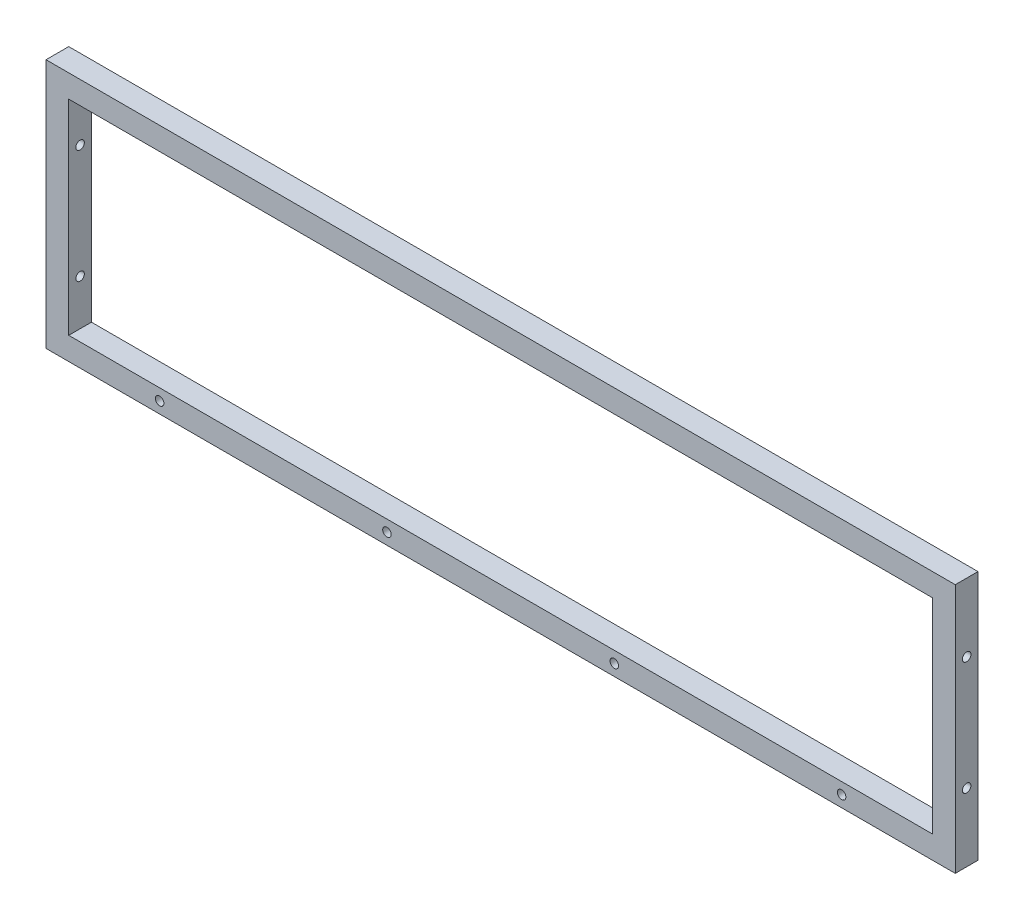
SolidWorks part; units mm, degrees
other "Outer tubes"
ref_plane "Front Plane" through (0, 0, 0) normal (0, 0, 1) x (1, 0, 0)
ref_plane "Top Plane" through (0, 0, 0) normal (0, 1, 0) x (1, 0, 0)
ref_plane "Right Plane" through (0, 0, 0) normal (1, 0, 0) x (0, 0, -1)
sketch "Sketch1" plane through (0, 0, 0) normal (0, 0, 1) x (1, 0, 0)
  line L1 (482.6, -114.3) -> (-482.6, -114.3)
  line L2 (482.6, -114.3) -> (482.6, 114.3)
  line L3 (482.6, 114.3) -> (-482.6, 114.3)
  line L4 (-482.6, -114.3) -> (-482.6, 114.3)
  line L5 (482.6, -114.3) -> (-482.6, 114.3) construction
  line L6 (482.6, 114.3) -> (-482.6, -114.3) construction
  line L7 (508, -139.7) -> (-508, -139.7)
  line L8 (508, -139.7) -> (508, 139.7)
  line L9 (508, 139.7) -> (-508, 139.7)
  line L10 (-508, -139.7) -> (-508, 139.7)
  line L11 (508, -139.7) -> (-508, 139.7) construction
  line L12 (508, 139.7) -> (-508, -139.7) construction
  point P0 (0, 0)
  point P6 (0, 0)
  dimension "D1" = 965.2
  dimension "D2" = 1016
  dimension "9" = 228.6
  dimension "11" = 279.4
extrude "Boss-Extrude1" add sketch "Sketch1" along normal blind 25.4
shell "Shell1" [suppressed] thickness 1.5875
hole_wizard "3/8 (0.375) Diameter Hole5" positions "Sketch13" profile "Sketch12" hole size "3/8" standard "ANSI Inch"
sketch "Sketch13" plane through (0, 0, 25.4) normal (0, 0, 1) x (1, 0, 0)
  line L0 (-508, -139.7) -> (508, -139.7) construction
  line L1 (-508, 139.7) -> (-508, -139.7) construction
  point P0 (-381, -127)
  point P2 (-127, -127)
  dimension "D1" = 12.7
  dimension "D2" = 127
  dimension "D3" = 254
sketch "Sketch12" plane through (-381, -127, 25.4) normal (1, 0, 0) x (0, -1, 0)
  line L0 (0, 0) -> (0, 25.4)
  line L1 (0, 25.4) -> (4.7625, 25.4)
  line L2 (4.7625, 25.4) -> (4.7625, 0)
  line L5 (4.7625, 0) -> (0, 0)
  line L11 (0, -6.35) -> (0, 107.95) construction
  dimension "Thru Hole Dia." = 9.525
  dimension "Thru Hole Depth" = 25.4
mirror "Mirror3" about plane through (0, 0, 0) normal (1, 0, 0) of "3/8 (0.375) Diameter Hole5"
sketch "Sketch14" plane through (508, 0, 0) normal (1, 0, 0) x (0, 0, -1)
  line L0 (-12.7, 139.7) -> (-12.7, -139.7) construction
  line L1 (-25.4, 139.7) -> (0, 139.7) construction
  line L2 (-25.4, -139.7) -> (0, -139.7) construction
  line L3 (-12.7, 0) -> (92.985, 0) construction
  circle A0 centre (-12.7, 63.5) radius 4.7625
  circle A1 centre (-12.7, -63.5) radius 4.7625
  dimension "D1" = 9.525
  dimension "D2" = 76.2
extrude "Cut-Extrude1" cut sketch "Sketch14" against normal through all
